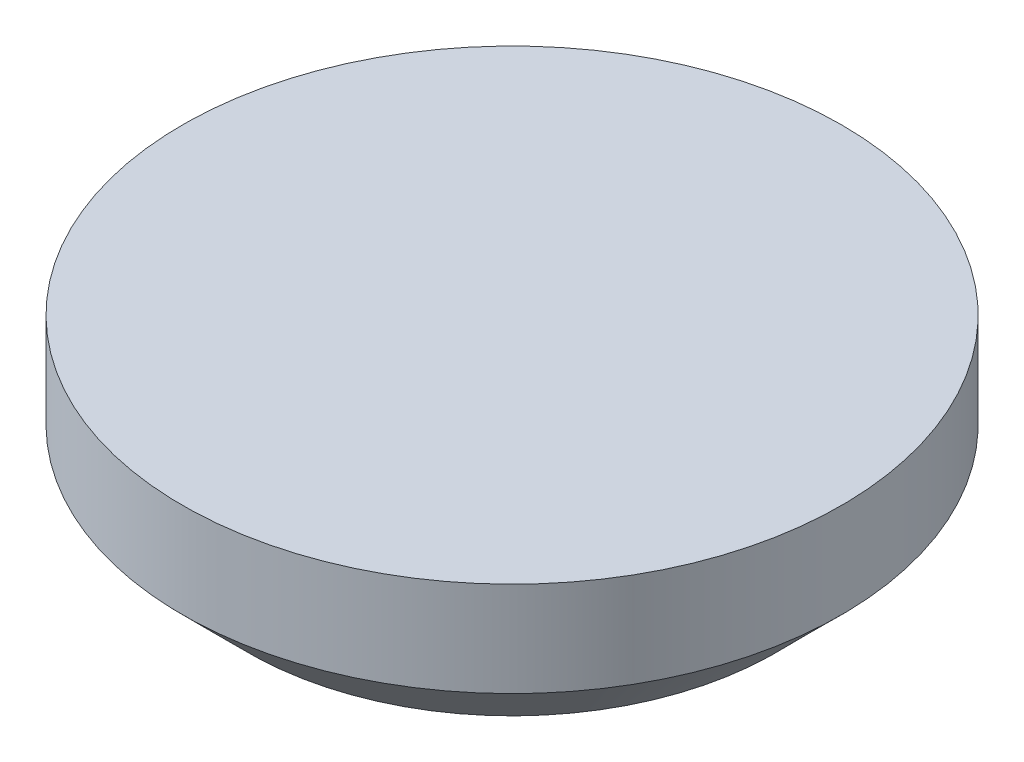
SolidWorks part; units mm, degrees
ref_plane "前视基准面" through (0, 0, 0) normal (0, 0, 1) x (1, 0, 0)
ref_plane "上视基准面" through (0, 0, 0) normal (0, 1, 0) x (1, 0, 0)
ref_plane "右视基准面" through (0, 0, 0) normal (1, 0, 0) x (0, 0, -1)
sketch "草图1" plane through (0, 0, 0) normal (0, 0, 1) x (1, 0, 0)
  line L0 (0, 0) -> (0, 528.9135) construction
  line L1 (0, 390) -> (800, 390)
  line L2 (800, 390) -> (800, 160)
  line L3 (800, 160) -> (640, 0)
  line L4 (640, 0) -> (0, 0)
  line L5 (0, 0) -> (0, 390)
  dimension "D1" = 230
  dimension "D2" = 160
  dimension "D3" = 1600
  dimension "D4" = 1280
revolve "旋转1" add sketch "草图1" angle 360 about L0
